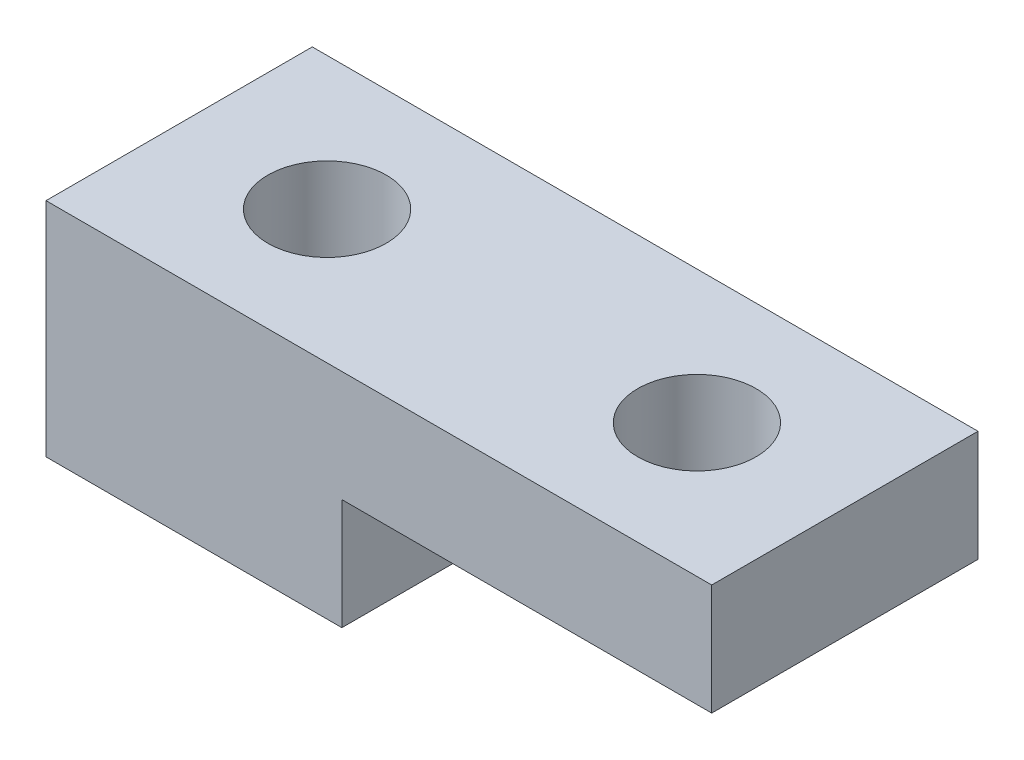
SolidWorks part; units mm, degrees
ref_plane "Face" through (0, 0, 0) normal (0, 0, 1) x (1, 0, 0)
ref_plane "Dessus" through (0, 0, 0) normal (0, 1, 0) x (1, 0, 0)
ref_plane "Droite" through (0, 0, 0) normal (1, 0, 0) x (0, 0, -1)
sketch "Esquisse1" plane through (0, 0, 0) normal (0, 0, 1) x (1, 0, 0)
  line L0 (0, 0) -> (0, 15)
  line L1 (0, 15) -> (45, 15)
  line L2 (45, 15) -> (45, 7.5)
  line L3 (45, 7.5) -> (20, 7.5)
  line L4 (20, 7.5) -> (20, 0)
  line L5 (20, 0) -> (0, 0)
  dimension "D1" = 45
  dimension "D2" = 20
  dimension "D3" = 15
  dimension "D4" = 7.5
extrude "Extrusion1" add sketch "Esquisse1" along normal mid plane 18
sketch "Esquisse2" plane through (0, 15, 0) normal (0, 1, 0) x (-1, 0, 0)
  line L0 (0, 9) -> (0, -9) construction
  line L1 (-45, 9) -> (-45, -9) construction
  circle A0 centre (-10, 0) radius 4
  circle A1 centre (-35, 0) radius 4
  dimension "D1" = 8
  dimension "D2" = 10
  dimension "D3" = 10
extrude "Enlèv. mat.-Extru.1" cut sketch "Esquisse2" against normal through all
